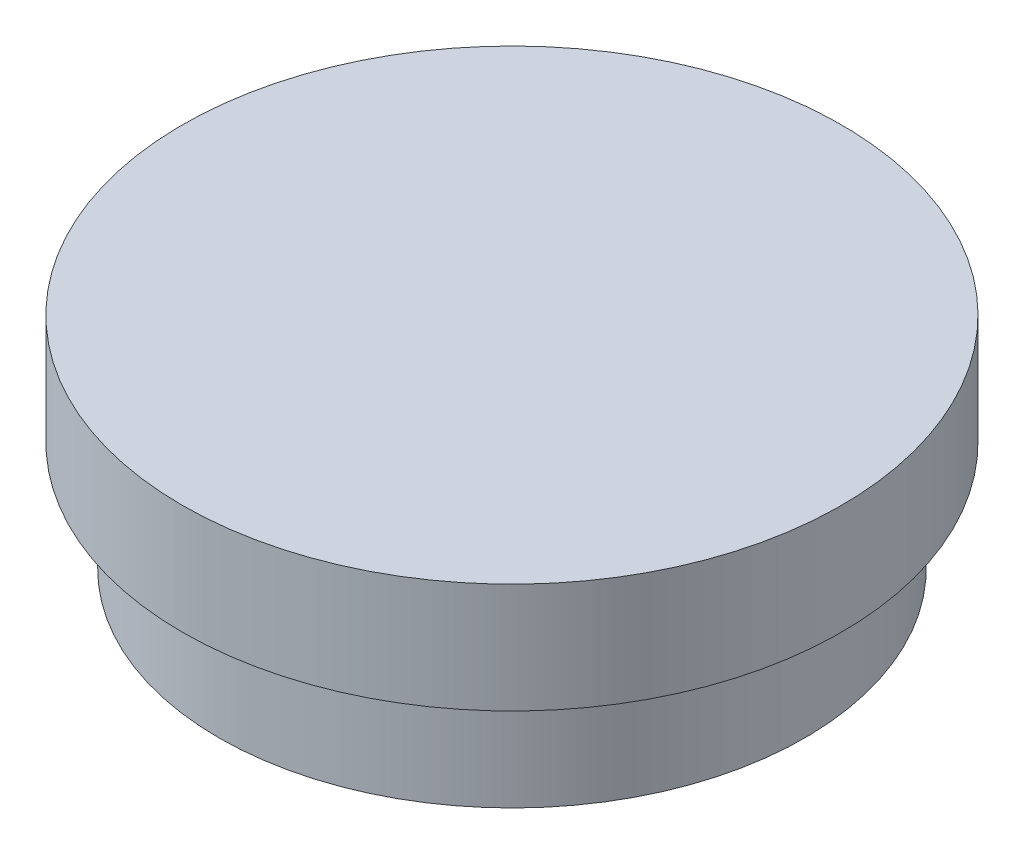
SolidWorks part; units mm, degrees
ref_plane "Front Plane" through (0, 0, 0) normal (0, 0, 1) x (1, 0, 0)
ref_plane "Top Plane" through (0, 0, 0) normal (0, 1, 0) x (1, 0, 0)
ref_plane "Right Plane" through (0, 0, 0) normal (1, 0, 0) x (0, 0, -1)
sketch "Sketch1" plane through (0, 0, 0) normal (0, 1, 0) x (1, 0, 0)
  circle A0 centre (0, 0) radius 80
  dimension "D1" = 160
extrude "Case Mate" add sketch "Sketch1" along normal blind 30 contours A0
sketch "Sketch2" plane through (0, 30, 0) normal (0, 1, 0) x (1, 0, 0)
  circle A0 centre (0, 0) radius 90
  dimension "D1" = 180
extrude "End Cap" add sketch "Sketch2" along normal blind 30
